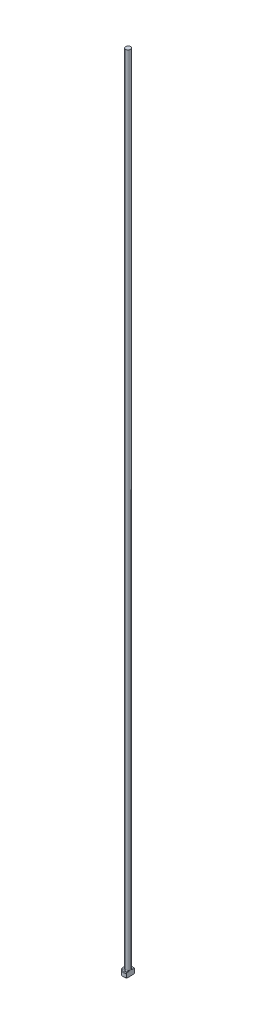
SolidWorks part; units mm, degrees
ref_plane "Front Plane" through (0, 0, 0) normal (0, 0, 1) x (1, 0, 0)
ref_plane "Top Plane" through (0, 0, 0) normal (0, 1, 0) x (1, 0, 0)
ref_plane "Right Plane" through (0, 0, 0) normal (1, 0, 0) x (0, 0, -1)
sketch "Sketch1" plane through (0, 0, 0) normal (0, 0, 1) x (1, 0, 0)
  line L0 (0, 259.9588) -> (0, -15.1925) construction
  line L1 (0, 0) -> (-1.5, 0)
  line L2 (-1.5, 0) -> (-1.5, 1.5)
  line L3 (-1.5, 1.5) -> (-0.75, 1.5)
  line L4 (-0.75, 1.5) -> (-0.75, 250)
  line L5 (-0.75, 250) -> (0, 250)
  line L6 (0, 250) -> (0, 0)
  dimension "L" = 250
  dimension "H" = 3
  dimension "T" = 1.5
  dimension "D" = 1.5
revolve "Revolve1" add sketch "Sketch1" angle 360 about L0
chamfer "Chamfer1" distance 0.2 angle 45 2 edges at (0, 1.5, 1.5) (0, 0, 1.5)
fillet "Fillet1" radius 0.2 1 edges at (0, 1.5, 0.75)
sketch "Sketch2" plane through (0, 0, 0) normal (0, 1, 0) x (1, 0, 0)
  line L0 (0.75, 1.299) -> (0.75, -1.299)
  circle A0 centre (0, 0) radius 1.5 construction
  arc A1 (0.75, -1.299) -> (0.75, 1.299) centre (0, 0) ccw
  circle A2 centre (0, 0) radius 0.75 construction
extrude "KEY" cut sketch "Sketch2" along normal through all
